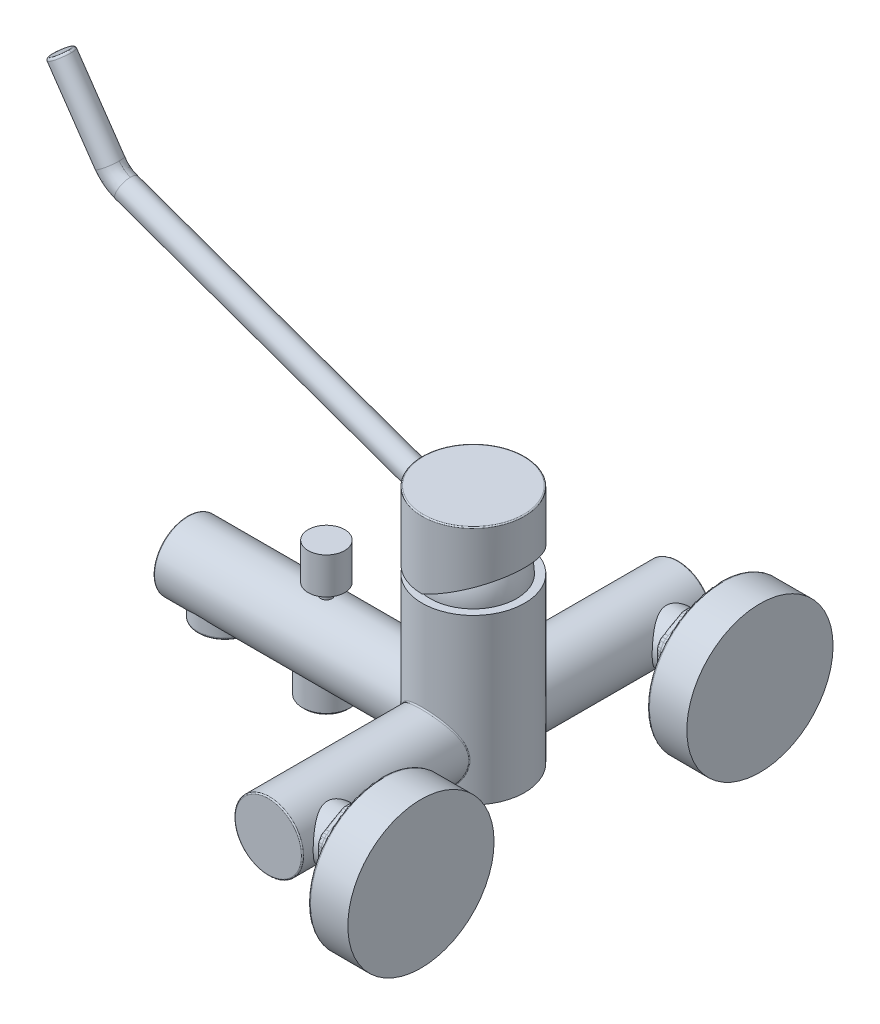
SolidWorks part; units mm, degrees
ref_plane "Front Plane" through (0, 0, 0) normal (0, 0, 1) x (1, 0, 0)
ref_plane "Top Plane" through (0, 0, 0) normal (0, 1, 0) x (1, 0, 0)
ref_plane "Right Plane" through (0, 0, 0) normal (1, 0, 0) x (0, 0, -1)
imported_body "Imported1"
fillet "Fillet1" radius 0.5
fillet "Fillet2" radius 0.5 2 edges at (-15, 17, 90) (15, 17, -90)
fillet "Fillet3" radius 1 2 edges at (34, 17, 42.306) (34, 17, -106.5)
fillet "Fillet4" radius 0.5 4 edges at (0, 32, 22.5) (-16.8568, 16.403, -14.903) (0, 2, -22.5) (-125.5, 1.5, 0)
